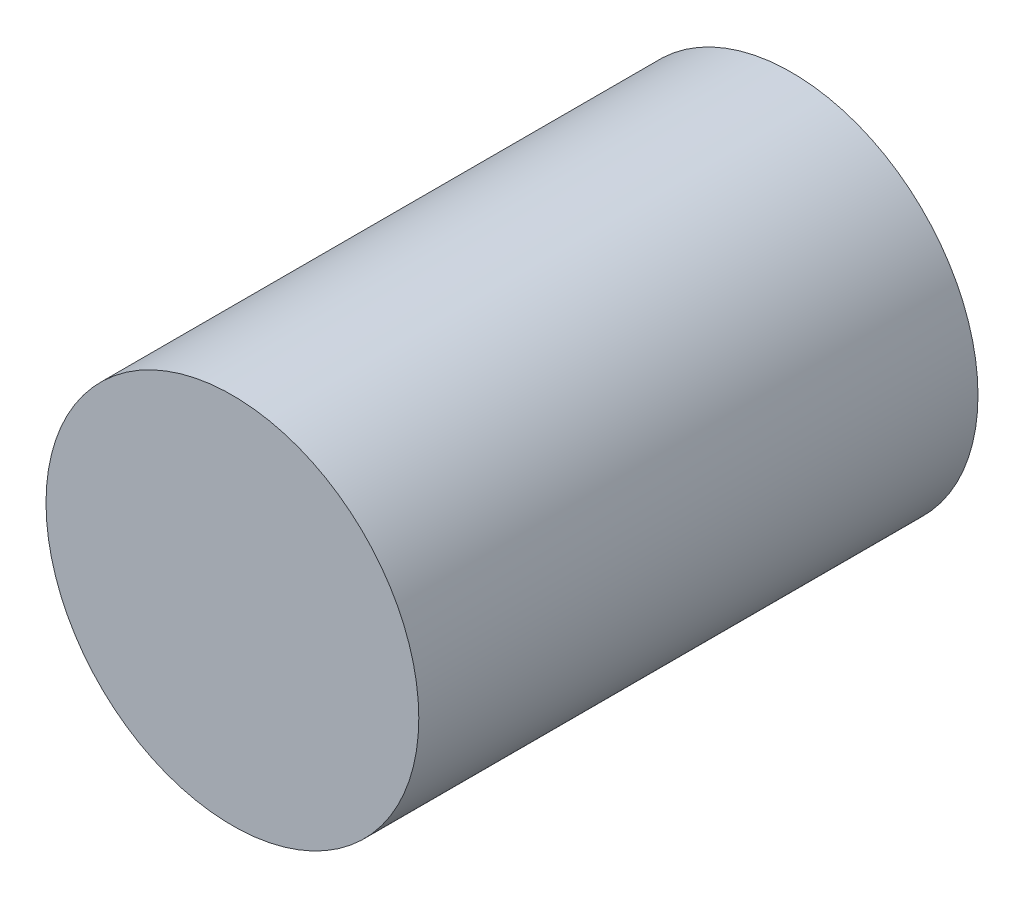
SolidWorks part; units mm, degrees
ref_plane "Plan de face" through (0, 0, 0) normal (0, 0, 1) x (1, 0, 0)
ref_plane "Plan de dessus" through (0, 0, 0) normal (0, 1, 0) x (1, 0, 0)
ref_plane "Plan de droite" through (0, 0, 0) normal (1, 0, 0) x (0, 0, -1)
sketch "Esquisse1" plane through (0, 0, 0) normal (0, 0, 1) x (1, 0, 0)
  circle A0 centre (0, 0) radius 4
extrude "Extrusion1" add sketch "Esquisse1" along normal blind 12
